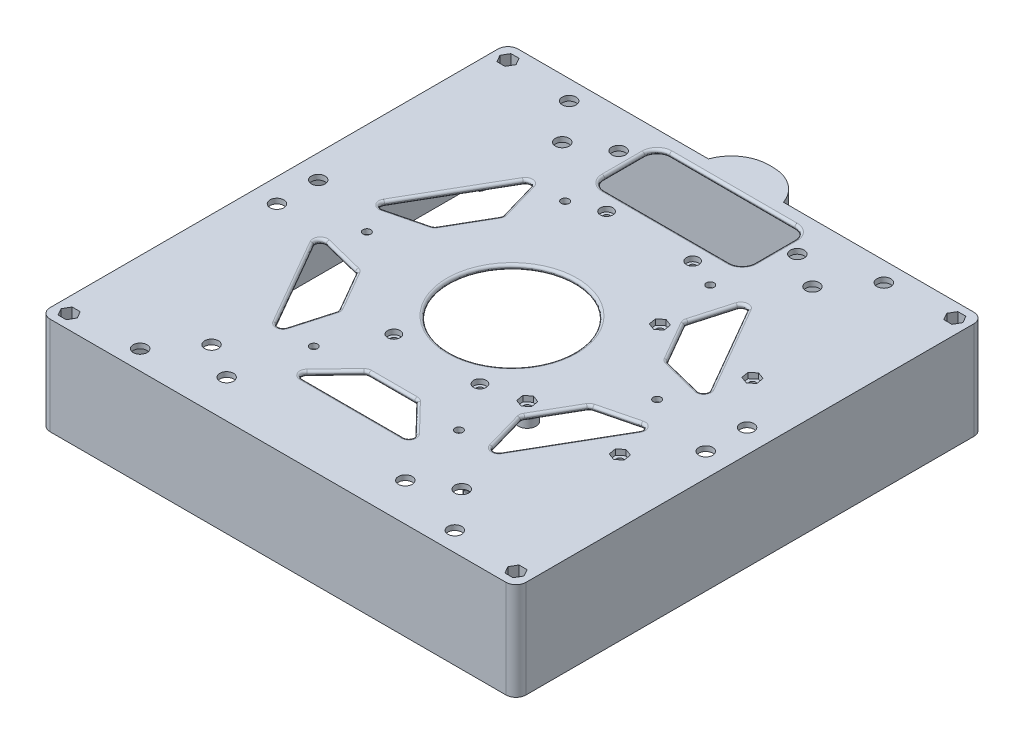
SolidWorks part; units mm, degrees
ref_plane "Front Plane" through (0, 0, 0) normal (0, 0, 1) x (1, 0, 0)
ref_plane "Top Plane" through (0, 0, 0) normal (0, 1, 0) x (1, 0, 0)
ref_plane "Right Plane" through (0, 0, 0) normal (1, 0, 0) x (0, 0, -1)
sketch "Sketch1" plane through (0, 0, 0) normal (0, 1, 0) x (1, 0, 0)
  line L0 (0, 0) -> (-77.46, 0) construction
  line L1 (-77.46, 0) -> (-77.46, 78.74) construction
  line L2 (-77.46, 0) -> (-77.46, -78.74) construction
  line L3 (0, 0) -> (54.62, 0) construction
  line L4 (54.62, 0) -> (54.62, 78.74) construction
  line L5 (77.46, 0) -> (77.46, -78.74) construction
  line L6 (54.62, 0) -> (77.46, 0) construction
  circle A0 centre (-77.46, 78.74) radius 5
  circle A1 centre (-77.46, -78.74) radius 5
  circle A2 centre (77.46, -78.74) radius 5
  circle A3 centre (54.62, 78.74) radius 5
  circle A4 centre (-77.46, 78.74) radius 1.5
  circle A5 centre (-77.46, -78.74) radius 1.5
  circle A6 centre (77.46, -78.74) radius 1.5
  circle A7 centre (54.62, 78.74) radius 1.5
  dimension "D5" = 10
  dimension "D6" = 3
  dimension "D1" = 78.74
  dimension "D2" = 77.46
  dimension "D3" = 77.46
  dimension "D4" = 22.84
extrude "Boss-Extrude1" add sketch "Sketch1" against normal blind 3
sketch "Sketch2" plane through (0, 0, 0) normal (0, 1, 0) x (1, 0, 0)
  line L0 (-77.46, 78.74) -> (-77.46, -78.74) construction
  line L1 (-77.46, -78.74) -> (77.46, -78.74) construction
  line L2 (0, 0) -> (111.5, 0) construction
  line L3 (0, 0) -> (0, 111.5) construction
  point P4 (0, 0)
  dimension "D1" = 111.5
sketch "Sketch4" plane through (0, 0, 0) normal (0, 1, 0) x (1, 0, 0)
  line L0 (77.46, -78.74) -> (-77.46, -78.74) construction
  line L1 (-77.46, -78.74) -> (-77.46, 78.74) construction
  line L2 (-77.46, 78.74) -> (54.62, 78.74) construction
  line L4 (95.09, -93.49) -> (-95.09, -93.49)
  line L5 (95.09, -93.49) -> (95.09, 93.49)
  line L6 (95.09, 93.49) -> (-95.09, 93.49)
  line L7 (-95.09, -93.49) -> (-95.09, 93.49)
  dimension "D1" = 17.63
  dimension "D2" = 17.63
  dimension "D3" = 14.75
  dimension "D4" = 14.75
extrude "Boss-Extrude2" add sketch "Sketch4" along normal blind 2
sketch "Sketch5" plane through (0, 0, 0) normal (0, -1, 0) x (1, 0, 0)
  line L15 (-95.09, -93.49) -> (-95.09, 93.49) construction
  line L20 (-91.59, -89.99) -> (91.59, -89.99)
  line L21 (-91.59, -89.99) -> (-91.59, 89.99)
  line L22 (-91.59, 89.99) -> (91.59, 89.99)
  line L23 (91.59, -89.99) -> (91.59, 89.99)
  line L24 (95.09, -93.49) -> (-95.09, -93.49) construction
  line L25 (95.09, 93.49) -> (95.09, -93.49) construction
  line L26 (-95.09, 93.49) -> (95.09, 93.49) construction
  line L28 (-95.09, -93.49) -> (95.09, -93.49)
  line L29 (-95.09, -93.49) -> (-95.09, 93.49)
  line L30 (-95.09, 93.49) -> (95.09, 93.49)
  line L31 (95.09, -93.49) -> (95.09, 93.49)
  dimension "D1" = 3.5
  dimension "D2" = 3.5
  dimension "D3" = 3.5
  dimension "D4" = 3.5
extrude "Boss-Extrude3" add sketch "Sketch5" along normal blind 7.58
sketch "Sketch7" plane through (0, 0, 0) normal (1, 0, 0) x (0, 0, -1)
  line L0 (0, 0) -> (0, -50.0007) construction
sketch "Sketch8" plane through (0, 0, 0) normal (0, -1, 0) x (1, 0, 0)
  line L0 (0, 0) -> (-58, 0) construction
  line L1 (0, 0) -> (-29, 50.2295) construction
  line L2 (0, 0) -> (29, 50.2295) construction
  line L3 (0, 0) -> (58, 0) construction
  line L4 (0, 0) -> (29, -50.2295) construction
  line L5 (0, 0) -> (-29, -50.2295) construction
  line L6 (0, 0) -> (-62.8771, 85.7222) construction
  line L7 (0, 0) -> (-49.9869, 70.0791) construction
  line L8 (0, 0) -> (-35.6968, 78.3295) construction
  line L9 (0, 0) -> (-42.799, 97.3142) construction
  circle A0 centre (-58, 0) radius 1.55
  circle A1 centre (-29, 50.2295) radius 1.55
  circle A2 centre (29, 50.2295) radius 1.55
  circle A3 centre (58, 0) radius 1.55
  circle A4 centre (29, -50.2295) radius 1.55
  circle A5 centre (-29, -50.2295) radius 1.55
  circle A6 centre (-35.6968, 78.3295) radius 2.75
  circle A7 centre (-49.9869, 70.0791) radius 2.75
  circle A8 centre (-62.8771, 85.7222) radius 2.75
  circle A9 centre (-42.799, 97.3142) radius 2.75
  circle A10 centre (62.8771, 85.7222) radius 2.75
  circle A11 centre (49.9869, 70.0791) radius 2.75
  circle A12 centre (35.6968, 78.3295) radius 2.75
  circle A13 centre (42.799, 97.3142) radius 2.75
  circle A14 centre (105.6761, -11.5921) radius 2.75
  circle A15 centre (85.6837, -8.2504) radius 2.75
  circle A16 centre (85.6837, 8.2504) radius 2.75
  circle A17 centre (105.6761, 11.5921) radius 2.75
  circle A18 centre (42.799, -97.3142) radius 2.75
  circle A19 centre (35.6968, -78.3295) radius 2.75
  circle A20 centre (49.9869, -70.0791) radius 2.75
  circle A21 centre (62.8771, -85.7222) radius 2.75
  circle A22 centre (-62.8771, -85.7222) radius 2.75
  circle A23 centre (-49.9869, -70.0791) radius 2.75
  circle A24 centre (-35.6968, -78.3295) radius 2.75
  circle A25 centre (-42.799, -97.3142) radius 2.75
  circle A26 centre (-105.6761, 11.5921) radius 2.75
  circle A27 centre (-85.6837, 8.2504) radius 2.75
  circle A28 centre (-85.6837, -8.2504) radius 2.75
  circle A29 centre (-105.6761, -11.5921) radius 2.75
  circle A30 centre (0, 0) radius 1.55
  point P16 (0, 0)
  point P66 (0, 0)
  dimension "D2" = 3.1
  dimension "D12" = 5.5
  dimension "D1" = 58
  dimension "D4" = 53.74
  dimension "D5" = 106.31
  dimension "D6" = 54.5
  dimension "D7" = 86.08
  dimension "D8" = 65.5
  dimension "D9" = 86.08
  dimension "D10" = 66.26
  dimension "D11" = 106.31
  dimension "D3" = 6
  dimension "D13" = 6
extrude "Cut-Extrude6" cut sketch "Sketch8" against normal through all
sketch "Sketch18" plane through (0, -7.58, 0) normal (0, -1, 0) x (1, 0, 0)
  line L1 (95.09, -93.49) -> (-95.09, -93.49)
  line L2 (95.09, -93.49) -> (95.09, -85.49)
  line L3 (95.09, 93.49) -> (-95.09, 93.49)
  line L4 (-95.09, -93.49) -> (-95.09, 21.49)
  line L5 (-91.59, 89.99) -> (91.59, 89.99)
  line L6 (-91.59, 89.99) -> (-91.59, 71.49)
  line L7 (-91.59, -89.99) -> (91.59, -89.99)
  line L16 (91.59, 89.99) -> (91.59, 43.49)
  line L18 (95.09, 43.49) -> (95.09, 93.49)
  line L19 (91.59, -85.49) -> (91.59, -89.99)
  line L23 (-91.59, 21.49) -> (-91.59, -89.99)
  line L24 (-95.09, 71.49) -> (-95.09, 93.49)
  line L25 (95.09, 43.49) -> (95.09, -85.49)
  line L26 (91.59, -85.49) -> (91.59, 43.49)
  line L27 (-95.09, 71.49) -> (-95.09, 21.49)
  line L28 (-91.59, 21.49) -> (-91.59, 71.49)
extrude "Boss-Extrude6" add sketch "Sketch18" along normal blind 29.42
sketch "Sketch20" plane through (0, -37, 0) normal (0, -1, 0) x (1, 0, 0)
  line L0 (-95.09, 93.49) -> (-95.09, -93.49) construction
  line L1 (-95.09, -93.49) -> (95.09, -93.49) construction
  line L4 (-95.09, 0) -> (128.4829, 0) construction
  line L7 (0, -93.49) -> (0, 93.49) construction
  line L8 (95.09, 93.49) -> (-95.09, 93.49) construction
  line L13 (-95.09, -93.49) -> (-84.5803, -92.6572)
  line L14 (-95.09, -93.49) -> (-92.6591, -82.5666)
  line L15 (-95.09, 93.49) -> (-92.6591, 82.5666)
  line L16 (-95.09, 93.49) -> (-84.5803, 92.6572)
  line L17 (95.09, 93.49) -> (84.5803, 92.6572)
  line L18 (95.09, 93.49) -> (92.6591, 82.5666)
  line L19 (95.09, -93.49) -> (92.6591, -82.5666)
  line L20 (95.09, -93.49) -> (84.5803, -92.6572)
  arc A4 (-84.5803, -92.6572) -> (-92.6591, -82.5666) centre (-91.59, -89.99) ccw
  arc A5 (-84.5803, 92.6572) -> (-92.6591, 82.5666) centre (-91.59, 89.99) cw
  arc A6 (84.5803, 92.6572) -> (92.6591, 82.5666) centre (91.59, 89.99) ccw
  arc A7 (84.5803, -92.6572) -> (92.6591, -82.5666) centre (91.59, -89.99) cw
  dimension "D1" = 15
extrude "Boss-Extrude7" add sketch "Sketch20" against normal up to next
sketch "Sketch21" plane through (0, -37, 0) normal (0, -1, 0) x (1, 0, 0)
  line L0 (-86.2867, -84.6867) -> (-95.09, -93.49) construction
  line L1 (-95.09, -93.49) -> (-89.2867, -93.49) construction
  line L2 (-95.09, -93.49) -> (-95.09, -87.6867) construction
  line L3 (-95.09, -87.6867) -> (-89.2867, -87.6867) construction
  line L4 (-89.2867, -93.49) -> (-89.2867, -87.6867) construction
  line L5 (0, -93.49) -> (0, 93.49) construction
  line L6 (-95.09, -93.49) -> (95.09, -93.49) construction
  line L7 (95.09, 93.49) -> (-95.09, 93.49) construction
  line L8 (0, 0) -> (-95.09, 0) construction
  line L9 (-95.09, 93.49) -> (-95.09, -93.49) construction
  arc A0 (-84.09, -89.99) -> (-91.59, -82.49) centre (-91.59, -89.99) ccw construction
  circle A1 centre (-89.2867, -87.6867) radius 1.55
  circle A2 centre (-89.2867, 87.6867) radius 1.55
  circle A3 centre (89.2867, -87.6867) radius 1.55
  circle A4 centre (89.2867, 87.6867) radius 1.55
  dimension "D2" = 3.1
  dimension "D1" = 3
extrude "Cut-Extrude9" cut sketch "Sketch21" against normal through all
sketch "Sketch22" plane through (0, 2, 0) normal (0, 1, 0) x (1, 0, 0)
  line L1 (87.6701, 84.8867) -> (90.9033, 84.8867)
  line L2 (90.9033, 84.8867) -> (92.5199, 87.6867)
  line L3 (92.5199, 87.6867) -> (90.9033, 90.4867)
  line L4 (90.9033, 90.4867) -> (87.6701, 90.4867)
  line L5 (87.6701, 90.4867) -> (86.0535, 87.6867)
  line L6 (86.0535, 87.6867) -> (87.6701, 84.8867)
  line L7 (95.09, 93.49) -> (-95.09, 93.49) construction
  line L8 (95.09, 0) -> (-95.09, 0) construction
  line L9 (95.09, -93.49) -> (95.09, 93.49) construction
  line L10 (-95.09, 93.49) -> (-95.09, -93.49) construction
  line L11 (0, 93.49) -> (0, -93.49) construction
  line L12 (-95.09, -93.49) -> (95.09, -93.49) construction
  line L13 (86.0535, -87.6867) -> (87.6701, -84.8867)
  line L14 (87.6701, -90.4867) -> (86.0535, -87.6867)
  line L15 (90.9033, -90.4867) -> (87.6701, -90.4867)
  line L16 (92.5199, -87.6867) -> (90.9033, -90.4867)
  line L17 (90.9033, -84.8867) -> (92.5199, -87.6867)
  line L18 (87.6701, -84.8867) -> (90.9033, -84.8867)
  line L19 (-86.0535, 87.6867) -> (-87.6701, 84.8867)
  line L20 (-87.6701, 90.4867) -> (-86.0535, 87.6867)
  line L21 (-90.9033, 90.4867) -> (-87.6701, 90.4867)
  line L22 (-92.5199, 87.6867) -> (-90.9033, 90.4867)
  line L23 (-90.9033, 84.8867) -> (-92.5199, 87.6867)
  line L24 (-87.6701, 84.8867) -> (-90.9033, 84.8867)
  line L25 (-87.6701, -90.4867) -> (-86.0535, -87.6867)
  line L26 (-90.9033, -90.4867) -> (-87.6701, -90.4867)
  line L27 (-92.5199, -87.6867) -> (-90.9033, -90.4867)
  line L28 (-90.9033, -84.8867) -> (-92.5199, -87.6867)
  line L29 (-87.6701, -84.8867) -> (-90.9033, -84.8867)
  line L30 (-86.0535, -87.6867) -> (-87.6701, -84.8867)
  circle A0 centre (89.2867, 87.6867) radius 2.8 construction
  dimension "D1" = 5.6
extrude "Cut-Extrude10" cut sketch "Sketch22" against normal blind 21.58
sketch "Sketch23" plane through (0, -3, 0) normal (0, -1, 0) x (1, 0, 0)
  circle A0 centre (77.46, 78.74) radius 5 construction
  circle A1 centre (-77.46, 78.74) radius 5 construction
  circle A2 centre (-77.46, -78.74) radius 5 construction
  circle A3 centre (54.62, -78.74) radius 5 construction
  circle A4 centre (77.46, 78.74) radius 5
  circle A5 centre (-77.46, 78.74) radius 5
  circle A6 centre (-77.46, -78.74) radius 5
  circle A7 centre (54.62, -78.74) radius 5
extrude "Cut-Extrude11" cut sketch "Sketch23" against normal blind 3
fillet "Fillet1" radius 4 4 edges at (-95.09, -17.5, 93.49) (-95.09, -17.5, -93.49) (95.09, -17.5, -93.49) (95.09, -17.5, 93.49)
sketch "Sketch24" plane through (0, 2, 0) normal (0, 1, 0) x (1, 0, 0)
  line L0 (24.9963, -63.5004) -> (-25.0037, -63.5004)
  line L1 (16.6595, -54.8857) -> (24.9963, -63.5004)
  line L2 (21.7148, -60.1096) -> (12.9438, -51.0462) construction
  line L3 (16.6595, -54.8857) -> (9.9963, -48.0004)
  line L4 (-0.0037, -48.0004) -> (9.9963, -48.0004)
  line L5 (5.7578, -48.0004) -> (-5.7652, -48.0004) construction
  line L6 (-0.0037, -48.0004) -> (-10.0037, -48.0004)
  line L7 (-17.5865, -55.836) -> (-25.0037, -63.5004)
  line L8 (-12.9512, -51.0462) -> (-21.7222, -60.1096) construction
  line L9 (-17.5865, -55.836) -> (-10.0037, -48.0004)
extrude "Cut-Extrude12" cut sketch "Sketch24" against normal blind 10
fillet "Fillet2" radius 2 4 edges at (9.9963, 1, 48.0004) (-10.0037, 1, 48.0004) (-25.0037, 1, 63.5004) (24.9963, 1, 63.5004)
pattern_circular "CirPattern1" count 3 every 60 about axis through (0, 0, 0) along (0, 1, 0) of "Cut-Extrude12", "Fillet2"
sketch "Sketch25" plane through (0, 0, 0) normal (0, -1, 0) x (1, 0, 0)
  line L1 (-17.2, 30.01) -> (17.2, 30.01) construction
  line L2 (-17.2, 30.01) -> (-17.2, -54.99) construction
  line L3 (-17.2, -54.99) -> (17.2, -54.99) construction
  line L4 (17.2, 30.01) -> (17.2, -54.99) construction
  line L5 (-17.2, 30.01) -> (17.2, -54.99) construction
  line L6 (-17.2, -54.99) -> (17.2, 30.01) construction
  line L7 (-84.09, -89.99) -> (84.09, -89.99) construction
  circle A0 centre (-17.2, -54.99) radius 2.5
  circle A1 centre (17.2, -54.99) radius 2.5
  circle A2 centre (17.2, 30.01) radius 2.5
  circle A3 centre (-17.2, 30.01) radius 2.5
  point P0 (0, -12.49)
  dimension "D3" = 5
  dimension "D4" = 35
  dimension "D1" = 34.4
  dimension "D2" = 85
extrude "Cut-Extrude13" cut sketch "Sketch25" against normal blind 13
sketch "Sketch26" plane through (0, 0, 0) normal (0, -1, 0) x (1, 0, 0)
  circle A0 centre (-17.2, -54.99) radius 3.5
  circle A1 centre (17.2, -54.99) radius 3.5
  circle A2 centre (17.2, 30.01) radius 3.5
  circle A3 centre (-17.2, 30.01) radius 3.5
  dimension "D1" = 7
  dimension "D2" = 2
  dimension "D3" = 2
extrude "Boss-Extrude8" add sketch "Sketch26" along normal blind 5
sketch "Sketch27" plane through (0, -5, 0) normal (0, -1, 0) x (1, 0, 0)
  circle A0 centre (-17.2, -54.99) radius 1.3
  circle A1 centre (17.2, -54.99) radius 1.3
  circle A2 centre (17.2, 30.01) radius 1.3
  circle A3 centre (-17.2, 30.01) radius 1.3
  dimension "D1" = 2.6
  dimension "D2" = 2
  dimension "D3" = 2
extrude "Cut-Extrude14" cut sketch "Sketch27" against normal blind 5
sketch "Sketch28" plane through (-91.59, 0, 0) normal (1, 0, 0) x (0, 0, -1)
  line L0 (-89.99, -37) -> (-89.99, 0) construction
  line L1 (-68.99, -22) -> (11.01, -22)
  line L2 (-68.99, -22) -> (-68.99, -2)
  line L3 (-68.99, -2) -> (11.01, -2)
  line L4 (11.01, -22) -> (11.01, -2)
  line L5 (-82.49, 0) -> (82.49, 0) construction
  dimension "D1" = 21
  dimension "D2" = 2
  dimension "D3" = 20
  dimension "D4" = 80
extrude "Cut-Extrude15" cut sketch "Sketch28" against normal blind 10
sketch "Sketch29" plane through (0, 0, 0) normal (0, -1, 0) x (1, 0, 0)
  line L0 (0, 0) -> (111.5, 0) construction
  line L1 (32.59, -26.5) -> (69.59, -26.5) construction
  line L2 (32.59, -26.5) -> (32.59, 26.5) construction
  line L3 (32.59, 26.5) -> (69.59, 26.5) construction
  line L4 (69.59, -26.5) -> (69.59, 26.5) construction
  line L5 (32.59, -26.5) -> (69.59, 26.5) construction
  line L6 (32.59, 26.5) -> (69.59, -26.5) construction
  line L7 (91.59, -82.49) -> (91.59, 82.49) construction
  point P0 (51.09, 0)
  dimension "D1" = 37
  dimension "D2" = 53
  dimension "D3" = 22
sketch "Sketch30" plane through (0, 0, 0) normal (0, -1, 0) x (1, 0, 0)
  circle A0 centre (32.59, 26.5) radius 3.5
  circle A1 centre (69.59, 26.5) radius 3.5
  circle A2 centre (69.59, -26.5) radius 3.5
  circle A3 centre (32.59, -26.5) radius 3.5
  dimension "D1" = 7
  dimension "D2" = 2
  dimension "D3" = 2
extrude "Boss-Extrude9" add sketch "Sketch30" along normal blind 5
sketch "Sketch31" plane through (0, 2, 0) normal (0, 1, 0) x (1, 0, 0)
  circle A0 centre (32.59, 26.5) radius 1.4
  circle A1 centre (69.59, 26.5) radius 1.4
  circle A2 centre (69.59, -26.5) radius 1.4
  circle A3 centre (32.59, -26.5) radius 1.4
  dimension "D1" = 2.8
  dimension "D2" = 2
  dimension "D3" = 2
extrude "Cut-Extrude16" cut sketch "Sketch31" against normal blind 15
sketch "Sketch32" plane through (0, 2, 0) normal (0, 1, 0) x (1, 0, 0)
  line L0 (35.4037, 25.4529) -> (34.9036, 28.4132)
  line L1 (72.4037, 25.4529) -> (71.9036, 28.4132)
  line L2 (71.9036, 28.4132) -> (69.0899, 29.4603)
  line L3 (69.0899, 29.4603) -> (66.7763, 27.5471)
  line L4 (66.7763, 27.5471) -> (67.2764, 24.5868)
  line L5 (67.2764, 24.5868) -> (70.0901, 23.5397)
  line L6 (70.0901, 23.5397) -> (72.4037, 25.4529)
  line L7 (34.9036, 28.4132) -> (32.0899, 29.4603)
  line L8 (32.0899, 29.4603) -> (29.7763, 27.5471)
  line L9 (29.7763, 27.5471) -> (30.2764, 24.5868)
  line L10 (30.2764, 24.5868) -> (33.0901, 23.5397)
  line L11 (33.0901, 23.5397) -> (35.4037, 25.4529)
  line L12 (35.4037, -27.5471) -> (34.9036, -24.5868)
  line L13 (34.9036, -24.5868) -> (32.0899, -23.5397)
  line L14 (32.0899, -23.5397) -> (29.7763, -25.4529)
  line L15 (29.7763, -25.4529) -> (30.2764, -28.4132)
  line L16 (30.2764, -28.4132) -> (33.0901, -29.4603)
  line L17 (33.0901, -29.4603) -> (35.4037, -27.5471)
  line L18 (72.4037, -27.5471) -> (71.9036, -24.5868)
  line L19 (71.9036, -24.5868) -> (69.0899, -23.5397)
  line L20 (69.0899, -23.5397) -> (66.7763, -25.4529)
  line L21 (66.7763, -25.4529) -> (67.2764, -28.4132)
  line L22 (67.2764, -28.4132) -> (70.0901, -29.4603)
  line L23 (70.0901, -29.4603) -> (72.4037, -27.5471)
  circle A0 centre (69.59, 26.5) radius 2.6 construction
  point P1 (68.6832, 24.0633)
  dimension "D1" = 5.2
  dimension "D2" = 2
  dimension "D3" = 2
extrude "Cut-Extrude17" cut sketch "Sketch32" against normal blind 2.2
sketch "Sketch33" plane through (0, 0, 0) normal (0, -1, 0) x (1, 0, 0)
  line L0 (91.59, -82.49) -> (91.59, 82.49) construction
  line L1 (47.59, 64.99) -> (88.59, 64.99) construction
  line L2 (47.59, 64.99) -> (47.59, 49.99) construction
  line L3 (47.59, 49.99) -> (88.59, 49.99) construction
  line L4 (88.59, 64.99) -> (88.59, 49.99) construction
  line L5 (47.59, 64.99) -> (88.59, 49.99) construction
  line L6 (47.59, 49.99) -> (88.59, 64.99) construction
  line L7 (84.09, 89.99) -> (-84.09, 89.99) construction
  point P0 (68.09, 57.49)
  dimension "D1" = 41
  dimension "D2" = 15
  dimension "D3" = 3
  dimension "D4" = 25
sketch "Sketch34" plane through (0, 0, 0) normal (0, -1, 0) x (1, 0, 0)
  circle A0 centre (88.59, 49.99) radius 1.5
  circle A1 centre (47.59, 49.99) radius 1.5
  circle A2 centre (47.59, 64.99) radius 1.5
  circle A3 centre (88.59, 64.99) radius 1.5
  dimension "D1" = 3
  dimension "D2" = 2
  dimension "D3" = 2
extrude "Boss-Extrude10" add sketch "Sketch34" along normal blind 5
sketch "Sketch35" plane through (0, -5, 0) normal (0, -1, 0) x (1, 0, 0)
  circle A0 centre (47.59, 49.99) radius 0.9
  circle A1 centre (88.59, 49.99) radius 0.9
  circle A2 centre (88.59, 64.99) radius 0.9
  circle A3 centre (47.59, 64.99) radius 0.9
  dimension "D1" = 1.8
  dimension "D2" = 2
  dimension "D3" = 2
extrude "Cut-Extrude18" cut sketch "Sketch35" against normal blind 5
sketch "Sketch36" plane through (0, 0, -93.49) normal (0, 0, -1) x (-1, 0, 0)
  line L0 (-91.09, 2) -> (91.09, 2) construction
  line L1 (-15, 2) -> (15, 2)
  line L2 (-15, 2) -> (-15, -37)
  line L3 (-15, -37) -> (15, -37)
  line L4 (15, 2) -> (15, -37)
  line L5 (91.09, -37) -> (-91.09, -37) construction
  line L6 (0, 0) -> (0, -50.0007) construction
  dimension "D1" = 30
  dimension "D2" = 15
extrude "Boss-Extrude11" add sketch "Sketch36" along normal blind 10
fillet "Fillet3" radius 15 2 edges at (15, -17.5, -103.49) (-15, -17.5, -103.49)
sketch "Sketch37" plane through (0, -37, 0) normal (0, -1, 0) x (1, 0, 0)
  line L0 (0, 0) -> (0, -111.5) construction
  line L1 (-84.09, -89.99) -> (84.09, -89.99) construction
  circle A0 centre (0, -97.99) radius 3.5
  dimension "D1" = 7
  dimension "D2" = 8
extrude "Cut-Extrude19" cut sketch "Sketch37" against normal blind 33
sketch "Sketch38" plane through (0, 0, 0) normal (0, -1, 0) x (1, 0, 0)
  line L0 (-84.09, -89.99) -> (84.09, -89.99) construction
  line L1 (-82.9253, -44.99) -> (-57.9253, -44.99) construction
  line L2 (-82.9253, -44.99) -> (-82.9253, -79.99) construction
  line L3 (-82.9253, -79.99) -> (-57.9253, -79.99) construction
  line L4 (-57.9253, -44.99) -> (-57.9253, -79.99) construction
  dimension "D1" = 25
  dimension "D2" = 35
  dimension "D3" = 10
sketch "Sketch40" plane through (0, 0, 0) normal (0, -1, 0) x (1, 0, 0)
  circle A0 centre (0, 0) radius 25
  dimension "D1" = 50
extrude "Cut-Extrude21" cut sketch "Sketch40" against normal blind 33
sketch "Sketch41" plane through (0, 0, 0) normal (0, -1, 0) x (1, 0, 0)
  circle A0 centre (-57.9253, -44.99) radius 2
  circle A1 centre (-82.9253, -44.99) radius 2
  circle A2 centre (-82.9253, -79.99) radius 2
  circle A3 centre (-57.9253, -79.99) radius 2
  dimension "D1" = 4
  dimension "D2" = 2
  dimension "D3" = 2
extrude "Boss-Extrude12" add sketch "Sketch41" along normal blind 5
sketch "Sketch42" plane through (0, -5, 0) normal (0, -1, 0) x (1, 0, 0)
  circle A0 centre (-82.9253, -44.99) radius 1.05
  circle A1 centre (-57.9253, -44.99) radius 1.05
  circle A2 centre (-57.9253, -79.99) radius 1.05
  circle A3 centre (-82.9253, -79.99) radius 1.05
  dimension "D1" = 2.1
  dimension "D2" = 2
  dimension "D3" = 2
extrude "Cut-Extrude22" cut sketch "Sketch42" against normal blind 5
fillet "Fillet4" radius 2 16 edges at (88.59, 0, 51.49) (88.59, 0, 66.49) (47.59, 0, 66.49) (47.59, 0, 51.49) (17.2, 0, 33.51) (-17.2, 0, 33.51) (69.59, 0, 30) (32.59, 0, 30) (69.59, 0, -23) (32.59, 0, -23) (17.2, 0, -51.49) (-17.2, 0, -51.49) (-57.9253, 0, -77.99) (-82.9253, 0, -77.99) (-57.9253, 0, -42.99) (-82.9253, 0, -42.99)
fillet "Fillet5" radius 2 1 edges at (0, -37, -101.49)
fillet "Fillet6" radius 3 4 edges at (-93.34, -2, -11.01) (-93.34, -22, -11.01) (-93.34, -2, 68.99) (-93.34, -22, 68.99)
sketch "Sketch43" plane through (0, 0, 0) normal (0, -1, 0) x (1, 0, 0)
  line L0 (0, 0) -> (0, -111.5) construction
  line L1 (30, -61.99) -> (-30, -61.99)
  line L2 (30, -61.99) -> (30, -87.99)
  line L3 (30, -87.99) -> (-30, -87.99)
  line L4 (-30, -61.99) -> (-30, -87.99)
  line L5 (30, -61.99) -> (-30, -87.99) construction
  line L6 (30, -87.99) -> (-30, -61.99) construction
  line L7 (-84.09, -89.99) -> (84.09, -89.99) construction
  point P0 (0, -74.99)
  dimension "D1" = 60
  dimension "D2" = 26
  dimension "D3" = 2
extrude "Cut-Extrude23" cut sketch "Sketch43" against normal blind 4
fillet "Fillet7" radius 5 4 edges at (30, 1, -87.99) (30, 1, -61.99) (-30, 1, -87.99) (-30, 1, -61.99)
fillet "Fillet8" radius 1 147 edges at (30, 2, -74.99) (30, 0, -74.99) (30, 1, -66.99) (30, 1, -82.99) (0, 2, -87.99) (0, 0, -87.99) (-25, 1, -87.99) (25, 1, -87.99) (0, 2, -61.99) (0, 0, -61.99) (-25, 1, -61.99) (25, 1, -61.99) (-30, 2, -74.99) (-30, 0, -74.99) (-30, 1, -66.99) (-30, 1, -82.99) (28.5355, 0, -86.5255) (28.5355, 2, -86.5255) (28.5355, 0, -63.4545) (28.5355, 2, -63.4545) (-28.5355, 0, -86.5255) (-28.5355, 2, -86.5255) (-28.5355, 0, -63.4545) (-28.5355, 2, -63.4545) (-0.0037, 2, 48.0004) (-0.0037, 0, 48.0004) (-9.156, 1, 48.0004) (9.1486, 1, 48.0004) (16.1503, 2, 54.3596) (16.1503, 0, 54.3596) (21.7148, 1, 60.1096) (10.5858, 1, 48.6096) (-16.1577, 2, 54.3596) (-16.1577, 0, 54.3596) (-21.7222, 1, 60.1096) (-10.5932, 1, 48.6096) (-0.0037, 2, 63.5004) (-0.0037, 0, 63.5004) (20.2776, 1, 63.5004) (-20.285, 1, 63.5004) (9.9291, 2, 48.159) (9.9291, 0, 48.159) (-9.9365, 2, 48.159) (-9.9365, 0, 48.159) (-22.1265, 2, 62.2809) (-22.1265, 0, 62.2809) (22.1191, 2, 62.2809) (22.1191, 0, 62.2809) (-41.5714, 2, 23.997) (-41.5714, 0, 23.997) (-46.1476, 1, 16.0709) (-36.9953, 1, 31.9231) (-39.0016, 2, 41.1664) (-39.0016, 0, 41.1664) (-41.199, 1, 48.8604) (-36.8042, 1, 33.4724) (-55.1556, 2, 13.1868) (-55.1556, 0, 13.1868) (-62.9175, 1, 11.2428) (-47.3937, 1, 15.1308) (-54.9948, 2, 31.747) (-54.9948, 0, 31.747) (-44.8541, 1, 49.3111) (-65.1355, 1, 14.1828) (-36.7424, 2, 32.6783) (-36.7424, 0, 32.6783) (-46.6751, 2, 15.4742) (-46.6751, 0, 15.4742) (-65.0001, 2, 11.9784) (-65.0001, 0, 11.9784) (-42.8773, 2, 50.2961) (-42.8773, 0, 50.2961) (-41.5677, 2, -24.0034) (-41.5677, 0, -24.0034) (-36.9916, 1, -31.9295) (-46.1439, 1, -16.0773) (-55.1519, 2, -13.1932) (-55.1519, 0, -13.1932) (-62.9138, 1, -11.2492) (-47.39, 1, -15.1372) (-38.9979, 2, -41.1728) (-38.9979, 0, -41.1728) (-41.1953, 1, -48.8668) (-36.8005, 1, -33.4788) (-54.9911, 2, -31.7534) (-54.9911, 0, -31.7534) (-65.1318, 1, -14.1893) (-44.8504, 1, -49.3176) (-46.6714, 2, -15.4807) (-46.6714, 0, -15.4807) (-36.7387, 2, -32.6847) (-36.7387, 0, -32.6847) (-42.8736, 2, -50.3025) (-42.8736, 0, -50.3025) (-64.9964, 2, -11.9848) (-64.9964, 0, -11.9848) (41.5677, 2, 24.0034) (41.5677, 0, 24.0034) (36.9916, 1, 31.9295) (46.1439, 1, 16.0773) (55.1519, 2, 13.1932) (55.1519, 0, 13.1932) (62.9138, 1, 11.2492) (47.39, 1, 15.1372) (38.9979, 2, 41.1728) (38.9979, 0, 41.1728) (41.1953, 1, 48.8668) (36.8005, 1, 33.4788) (54.9911, 2, 31.7534) (45.6014, 0, 48.0168) (65.1318, 1, 14.1893) (46.6714, 2, 15.4807) (46.6714, 0, 15.4807) (36.7387, 2, 32.6847) (36.7387, 0, 32.6847) (42.8736, 2, 50.3025) (42.3535, 0, 50.1655) (64.9964, 2, 11.9848) (64.9964, 0, 11.9848) (41.5714, 2, -23.997) (41.5714, 0, -23.997) (46.1476, 1, -16.0709) (36.9953, 1, -31.9231) (39.0016, 2, -41.1664) (39.0016, 0, -41.1664) (41.199, 1, -48.8604) (36.8042, 1, -33.4724) (55.1556, 2, -13.1868) (55.1556, 0, -13.1868) (62.9175, 1, -11.2428) (47.3937, 1, -15.1308) (54.9948, 2, -31.747) (54.9948, 0, -31.747) (44.8541, 1, -49.3111) (65.1355, 1, -14.1828) (36.7424, 2, -32.6783) (36.7424, 0, -32.6783) (46.6751, 2, -15.4742) (46.6751, 0, -15.4742) (65.0001, 2, -11.9784) (65.0001, 0, -11.9784) (42.8773, 2, -50.2961) (42.8773, 0, -50.2961) (0, 0, -25) (0, 2, 25) (44.5214, 0, 49.7429) (55.7421, 0, 30.4527)
